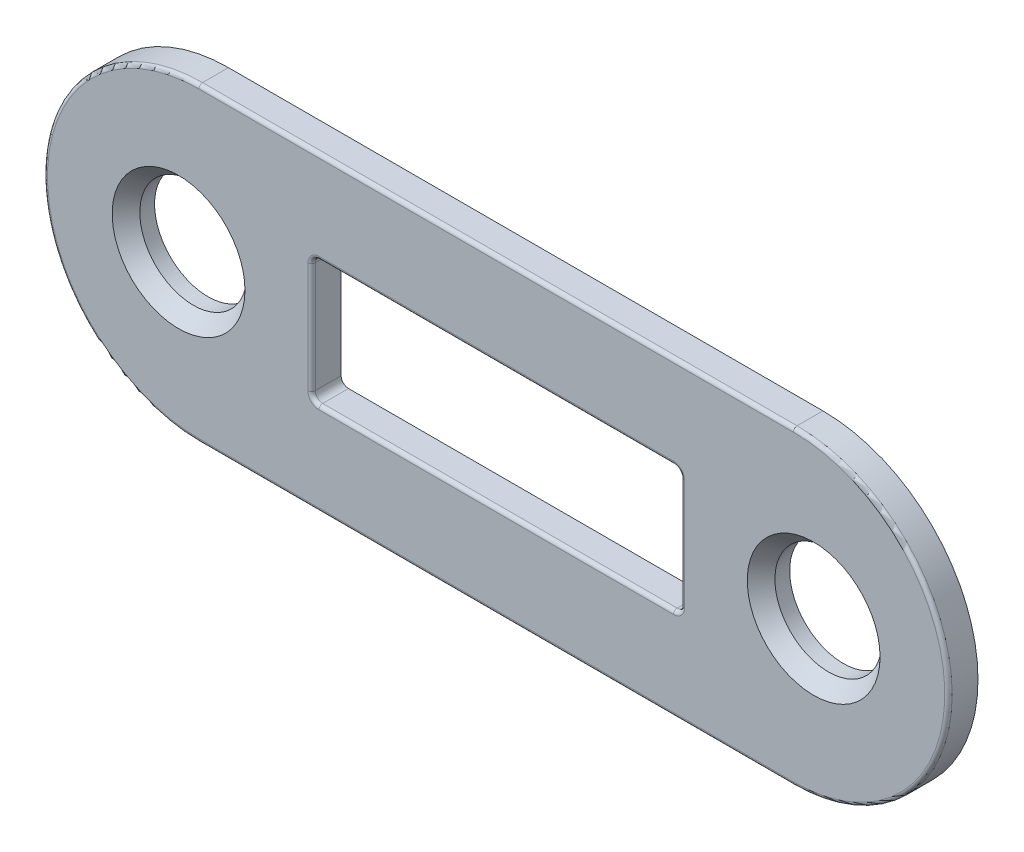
SolidWorks part; units mm, degrees
ref_plane "Plane1" through (0, 0, 0) normal (0, 0, 1) x (1, 0, 0)
ref_plane "Plane2" through (0, 0, 0) normal (0, 1, 0) x (1, 0, 0)
ref_plane "Plane3" through (0, 0, 0) normal (1, 0, 0) x (0, 0, -1)
sketch "Sketch3" plane through (0, 0, 0) normal (0, 0, 1) x (1, 0, 0)
  line L1 (0, 0) -> (40.25, 0)
  line L3 (0, 21) -> (40.25, 21)
  line L4 (-10.5, 38.5) -> (-10.5, -13.5) construction
  line L6 (50.75, 21) -> (50.75, -7.3025) construction
  line L8 (20.125, 21) -> (20.125, 0) construction
  arc A0 (40.25, 21) -> (40.25, 0) centre (40.25, 10.5) cw
  arc A1 (0, 21) -> (0, 0) centre (0, 10.5) ccw
  point P28 (-28.2378, 41.6012)
  dimension "D1" = 10.5
  dimension "D4" = 61.25
extrude "Base-Extrude" add sketch "Sketch3" along normal blind 2
fillet "Fillet1" radius 0.25 4 edges at (50.75, 10.5, 2) (20.125, 0, 2) (-10.5, 10.5, 2) (20.125, 21, 2)
sketch "Sketch6" plane through (0, 0, 2) normal (0, 0, 1) x (1, 0, 0)
  line L2 (20.125, 0.8334) -> (20.125, 21.3334) construction
  line L7 (7.63, 14.25) -> (7.63, 10.5)
  line L8 (7.63, 10.5) -> (7.63, 6.75)
  line L9 (8.13, 6.25) -> (12.8001, 6.25)
  line L10 (12.8001, 6.25) -> (27.4499, 6.25)
  line L11 (27.4499, 6.25) -> (32.13, 6.25)
  line L12 (32.63, 6.75) -> (32.63, 10.5)
  line L13 (32.63, 10.5) -> (32.63, 14.25)
  line L14 (32.13, 14.75) -> (27.4499, 14.75)
  line L15 (27.4499, 14.75) -> (12.8001, 14.75)
  line L16 (12.8001, 14.75) -> (8.13, 14.75)
  line L17 (5.3001, 14.9166) -> (5.3001, 10.4166) construction
  line L18 (5.3001, 10.4166) -> (5.3001, 5.9166) construction
  line L19 (8.3001, 2.9166) -> (12.8001, 2.9166) construction
  line L20 (12.8001, 2.9166) -> (27.8001, 2.9166) construction
  line L21 (27.8001, 2.9166) -> (32.3001, 2.9166) construction
  line L22 (35.3001, 5.9166) -> (35.3001, 10.4166) construction
  line L23 (35.3001, 10.4166) -> (35.3001, 14.9166) construction
  line L24 (32.3001, 17.9166) -> (27.8001, 17.9166) construction
  line L25 (27.8001, 17.9166) -> (12.8001, 17.9166) construction
  line L26 (12.8001, 17.9166) -> (8.3001, 17.9166) construction
  line L27 (-10.25, 10.5) -> (50.5, 10.5) construction
  line L28 (7.63, 10.5) -> (32.63, 10.5) construction
  line L29 (20.125, 14.75) -> (20.125, 6.25) construction
  arc A0 (32.63, 6.75) -> (32.13, 6.25) centre (32.13, 6.75) cw
  arc A1 (32.13, 14.75) -> (32.63, 14.25) centre (32.13, 14.25) cw
  arc A2 (7.63, 6.75) -> (8.13, 6.25) centre (8.13, 6.75) ccw
  arc A3 (0, 21) -> (0, 0) centre (0, 10.5) ccw construction
  arc A4 (40.25, 0) -> (40.25, 21) centre (40.25, 10.5) ccw construction
  arc A5 (8.13, 14.75) -> (7.63, 14.25) centre (8.13, 14.25) ccw
  arc A6 (5.3001, 5.9166) -> (8.3001, 2.9166) centre (8.3001, 5.9166) ccw construction
  arc A7 (32.3001, 2.9166) -> (35.3001, 5.9166) centre (32.3001, 5.9166) ccw construction
  arc A8 (35.3001, 14.9166) -> (32.3001, 17.9166) centre (32.3001, 14.9166) ccw construction
  arc A9 (8.3001, 17.9166) -> (5.3001, 14.9166) centre (8.3001, 14.9166) ccw construction
  arc A10 (0, 20.75) -> (0, 0.25) centre (0, 10.5) ccw construction
  arc A11 (40.25, 0.25) -> (40.25, 20.75) centre (40.25, 10.5) ccw construction
  dimension "D2" = 0.5
  dimension "D4" = 0.5
  dimension "D5" = 0.5
  dimension "D6" = 0.5
  dimension "D1" = 25
  dimension "D3" = 8.5
  dimension "D7" = 4.25
  dimension "D8" = 7.63
  dimension "D9" = 7.62
extrude "Cut-Extrude2" cut sketch "Sketch6" against normal through all
hole_wizard "CSK for 1/4 Flat Head Socket Cap Screw1" positions "3DSketch1" profile "Sketch7" countersink size "1/4" standard "Ansi Inch"
sketch3d "3DSketch1"
  line L0 (0, 10.5, 2) -> (40.25, 10.5, 2) construction
  line L1 (0, 10.5, -2.946) -> (0, 10.5, 11.142) construction
  line L2 (40.25, 10.5, -2.946) -> (40.25, 10.5, 11.142) construction
  line L5 (20.125, 21, 1.75) -> (20.125, 0, 1.75) construction
  line L6 (0, 21, 1.75) -> (40.25, 21, 1.75) construction
  line L7 (40.25, 0, 1.75) -> (0, 0, 1.75) construction
  point P0 (-1.3765, 10.5, 2)
  point P2 (41.6235, 10.5, 2)
  dimension "D1" = 43
  dimension "D2" = 21.5
sketch "Sketch7" plane through (-1.3765, 10.5, 2) normal (1, 0, 0) x (0, -1, 0)
  line L0 (0, 0) -> (0, 2)
  line L1 (0, 2) -> (3.625, 2)
  line L2 (3.625, 2) -> (3.625, 1.0017)
  line L3 (3.625, 1.0017) -> (4.4958, 0)
  line L5 (4.4958, 0) -> (0, 0)
  line L6 (-3.625, 1.0017) -> (-4.4958, 0) construction
  line L11 (0, -6.35) -> (0, 107.95) construction
  dimension "Thru Hole Dia." = 7.25
  dimension "Thru Hole Depth" = 2
  dimension "Near C'Sink Dia." = 8.9916
  dimension "Near C'Sink Angle" = 82
fillet "Fillet2" radius 0.25 8 edges at (7.63, 10.5, 2) (7.7764, 6.3964, 2) (20.13, 6.25, 2) (32.4836, 6.3964, 2) (32.63, 10.5, 2) (32.4836, 14.6036, 2) (20.13, 14.75, 2) (7.7764, 14.6036, 2)
